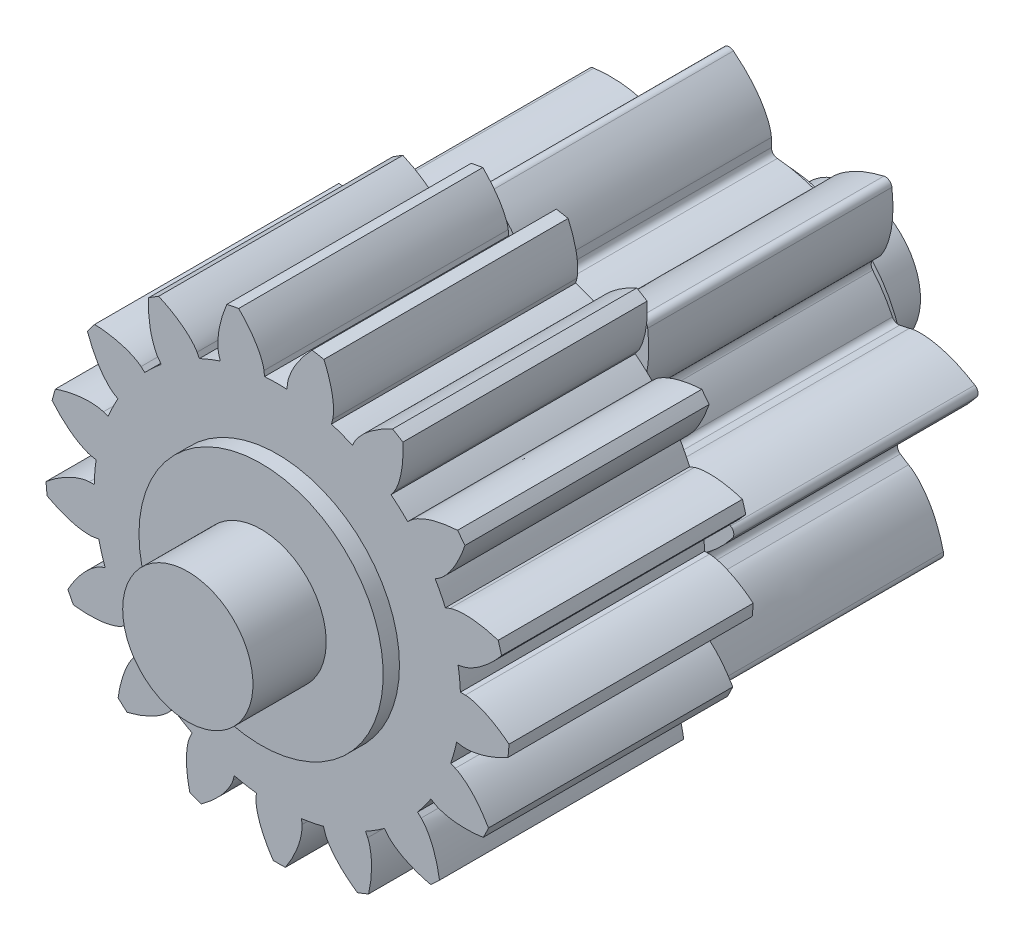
SolidWorks part; units mm, degrees
ref_plane "Plan de face" through (0, 0, 0) normal (0, 0, 1) x (1, 0, 0)
ref_plane "Plan de dessus" through (0, 0, 0) normal (0, 1, 0) x (1, 0, 0)
ref_plane "Plan de droite" through (0, 0, 0) normal (1, 0, 0) x (0, 0, -1)
imported_body "Importée3"
ref_plane "Plan4" through (0, -0.7465, 0) normal (0, -1, 0) x (1, 0, 0)
sketch "Esquisse1" plane through (0, -0.7465, 0) normal (0, -1, 0) x (1, 0, 0)
  line L0 (2.6324, 3.2) -> (1.8824, 3.2)
  line L1 (1.8824, 3.2) -> (1.8824, 2.65)
  line L2 (1.8824, 2.65) -> (2.2824, 2.65)
  line L3 (2.2824, 2.65) -> (2.2824, 3.1)
  line L4 (2.2824, 3.1) -> (2.6324, 3.1)
  line L5 (2.6324, 3.1) -> (2.6324, 3.2)
  line L6 (1.8824, 3.2) -> (1.8824, 2.65) construction
revolve "Révolution1" add sketch "Esquisse1" angle 360 about L6
sketch "Esquisse2" plane through (0, -0.7465, 0) normal (0, -1, 0) x (1, 0, 0)
  line L0 (2.2824, 6.75) -> (1.8824, 6.75)
  line L1 (1.8824, 6.75) -> (1.8824, 6.2)
  line L2 (1.8824, 6.2) -> (2.6324, 6.2)
  line L3 (2.6324, 6.2) -> (2.6324, 6.3)
  line L4 (2.6324, 6.3) -> (2.2824, 6.3)
  line L5 (2.2824, 6.3) -> (2.2824, 6.75)
  line L6 (1.8824, 6.75) -> (1.8824, 6.2) construction
revolve "Révolution2" add sketch "Esquisse2" angle 360 about L6
fillet "Congé1" radius 0.04 24 edges at (1.1125, -1.8485, 3.95) (1.0225, -0.712, 3.95) (1.0916, -1.086, 3.95) (2.6816, -1.0656, 3.95) (1.5633, -1.5457, 3.95) (3.206, -0.5116, 3.95) (1.25, -1.3301, 3.95) (2.9844, -1.5164, 3.95) (0.5588, -0.9813, 3.95) (2.6731, -0.407, 3.95) (1.9169, 0.1134, 3.95) (2.466, -1.3789, 3.95) (1.6476, 0.5771, 3.95) (2.5148, -0.1629, 3.95) (1.5429, 0.0443, 3.95) (2.2219, -1.5372, 3.95) (1.2988, -0.1141, 3.95) (0.7804, 0.0234, 3.95) (2.1172, -2.0701, 3.95) (1.0832, -0.4274, 3.95) (2.2015, 0.0527, 3.95) (2.7422, -0.781, 3.95) (1.8479, -1.6063, 3.95)
